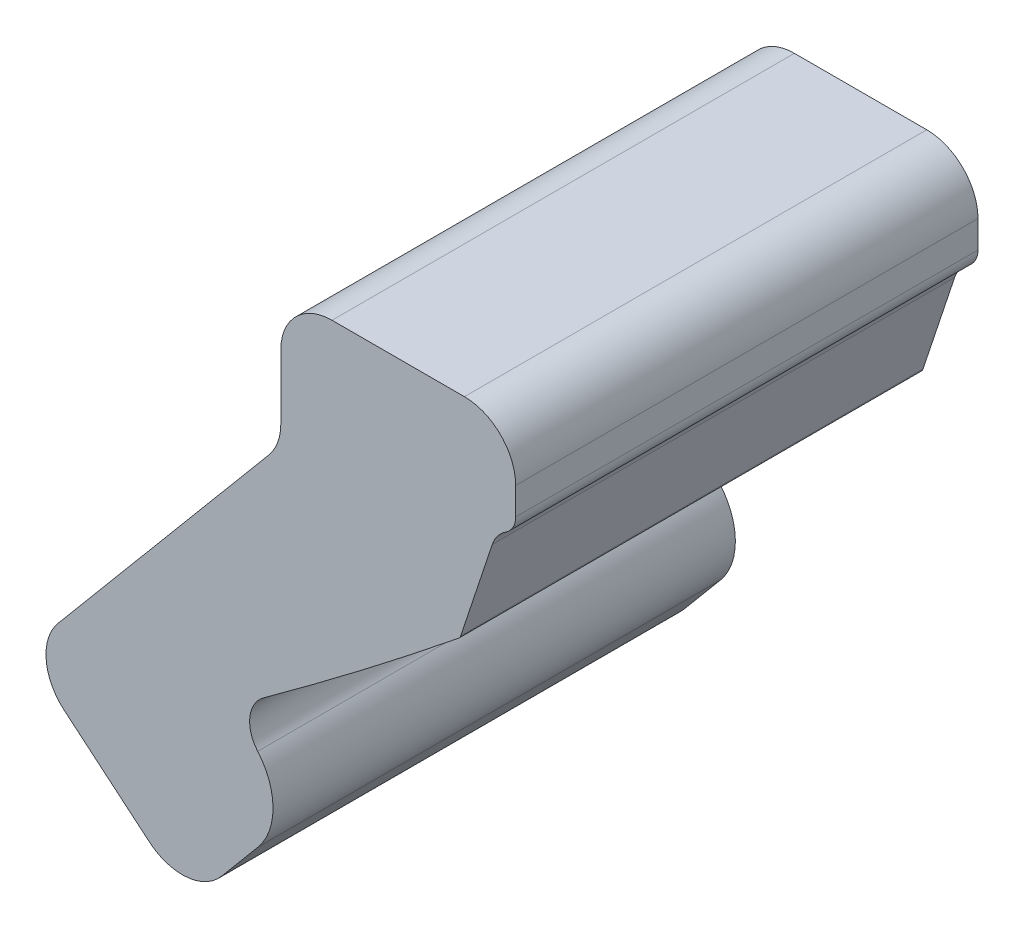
SolidWorks part; units mm, degrees
ref_plane "Front" through (0, 0, 0) normal (0, 0, 1) x (1, 0, 0)
ref_plane "Top" through (0, 0, 0) normal (0, 1, 0) x (1, 0, 0)
ref_plane "Right" through (0, 0, 0) normal (1, 0, 0) x (0, 0, -1)
ref_plane "Plane1" through (0, 0, 71.9582) normal (0, 0, -1) x (-1, 0, 0)
sketch "Sketch1" plane through (0, 0, 71.9582) normal (0, 0, -1) x (-1, 0, 0)
  line L0 (518.4098, -13.1992) -> (532.1912, -13.1992) construction
  line L1 (465.074, -13.1992) -> (532.1912, -13.1992) construction
  line L2 (499.999, -20.8192) -> (499.999, -30.3479)
  line L3 (501.7817, -35.2459) -> (533.1413, -72.6187)
  line L4 (532.202, -83.354) -> (519.5546, -93.9665)
  line L5 (508.8193, -93.0272) -> (466.8567, -43.0181)
  line L6 (465.074, -38.1201) -> (465.074, -20.8192)
  line L8 (472.694, -13.1992) -> (492.379, -13.1992)
  line L9 (459.359, -85.471) -> (459.359, 85.471) construction
  line L28 (467.1367, -5.4507) -> (467.185, -5.5063)
  line L29 (470.3379, -1.325) -> (467.2376, -4.0174)
  line L30 (456.0091, 21.2739) -> (456.1952, 20.2654)
  line L31 (432.0614, 60.5652) -> (432.2004, 59.493)
  line L32 (426.2261, 76.596) -> (425.7905, 73.9476)
  line L33 (431.1692, 80.4921) -> (428.913, 79.7432)
  line L34 (442.3922, 68.2309) -> (441.7414, 68.7387)
  line L35 (466.2786, 28.9295) -> (465.5868, 29.4112)
  line L36 (489.9966, -8.5838) -> (487.8267, -4.6121)
  line L37 (492.579, -13.0808) -> (489.9966, -8.5838)
  line L38 (498.4299, -23.7902) -> (492.579, -13.0808)
  line L39 (490.4548, -35.9487) -> (498.2502, -25.9811)
  line L40 (494.3611, -42.3275) -> (490.5046, -37.8868)
  line L41 (501.2714, -46.7609) -> (495.0911, -42.9478)
  line L42 (515.2956, -65.7245) -> (501.687, -50.0542)
  line L43 (515.0302, -67.9839) -> (515.0872, -67.5125)
  line L44 (521.0991, -73.879) -> (518.6037, -71.0056)
  line L45 (519.194, -76.5426) -> (521.0234, -74.954)
  line L46 (517.0322, -76.6445) -> (519.194, -76.5426)
  line L47 (509.4459, -72.1537) -> (513.3219, -74.806)
  line L48 (467.0862, -26.553) -> (472.9409, -44.1622)
  line L49 (478.6314, -13.0808) -> (479.9517, -15.9471)
  line L50 (477.5788, -10.904) -> (478.6314, -13.0808)
  line L51 (475.055, -5.5405) -> (477.5788, -10.904)
  line L52 (470.5161, -7.7925) -> (473.4927, -5.2075)
  line L53 (469.0345, -7.636) -> (469.0828, -7.6916)
  line L54 (467.1367, -5.4507) -> (467.185, -5.5063) construction
  line L55 (470.3379, -1.325) -> (467.2376, -4.0174) construction
  line L56 (456.0091, 21.2739) -> (456.1952, 20.2654) construction
  line L57 (432.0614, 60.5652) -> (432.2004, 59.493) construction
  line L58 (426.2261, 76.596) -> (425.7905, 73.9476) construction
  line L59 (431.1692, 80.4921) -> (428.913, 79.7432) construction
  line L60 (442.3922, 68.2309) -> (441.7414, 68.7387) construction
  line L61 (466.2786, 28.9295) -> (465.5868, 29.4112) construction
  line L62 (489.9966, -8.5838) -> (487.8267, -4.6121) construction
  line L63 (492.579, -13.0808) -> (489.9966, -8.5838) construction
  line L64 (498.4299, -23.7902) -> (492.579, -13.0808) construction
  line L65 (490.4548, -35.9487) -> (498.2502, -25.9811) construction
  line L66 (494.3611, -42.3275) -> (490.5046, -37.8868) construction
  line L67 (501.2714, -46.7609) -> (495.0911, -42.9478) construction
  line L68 (515.2956, -65.7245) -> (501.687, -50.0542) construction
  line L69 (515.0302, -67.9839) -> (515.0872, -67.5125) construction
  line L70 (521.0991, -73.879) -> (518.6037, -71.0056) construction
  line L71 (519.194, -76.5426) -> (521.0234, -74.954) construction
  line L72 (517.0322, -76.6445) -> (519.194, -76.5426) construction
  line L73 (509.4459, -72.1537) -> (513.3219, -74.806) construction
  line L74 (467.0862, -26.553) -> (472.9409, -44.1622) construction
  line L75 (478.6314, -13.0808) -> (479.9517, -15.9471) construction
  line L76 (477.5788, -10.904) -> (478.6314, -13.0808) construction
  line L78 (470.5161, -7.7925) -> (473.4927, -5.2075) construction
  line L79 (469.0345, -7.636) -> (469.0828, -7.6916) construction
  line L114 (475.055, -5.5405) -> (477.5788, -10.904) construction
  arc A1 (465.074, -20.8192) -> (472.694, -13.1992) centre (472.694, -20.8192) cw
  arc A2 (466.8567, -43.0181) -> (465.074, -38.1201) centre (472.694, -38.1201) cw
  arc A3 (533.1413, -72.6187) -> (532.202, -83.354) centre (527.304, -77.5168) cw
  arc A4 (499.999, -30.3479) -> (501.7817, -35.2459) centre (507.619, -30.3479) ccw
  arc A5 (499.999, -20.8192) -> (492.379, -13.1992) centre (492.379, -20.8192) ccw
  arc A6 (519.5546, -93.9665) -> (508.8193, -93.0272) centre (514.6566, -88.1292) cw
  arc A54 (468.6739, -6.8334) -> (469.0345, -7.636) centre (470.1852, -6.6367) ccw
  arc A55 (468.6739, -6.8334) -> (469.0345, -7.636) centre (470.1852, -6.6367) ccw construction
  arc A56 (467.2376, -4.0174) -> (467.1367, -5.4507) centre (467.9038, -4.7845) ccw
  arc A57 (470.3379, -1.325) -> (470.5052, -0.0019) centre (469.6822, -0.57) ccw
  arc A58 (458.0934, 18.4881) -> (470.5052, -0.0019) centre (1176.9045, 487.596) ccw
  arc A59 (457.85, 19.4364) -> (458.0934, 18.4881) centre (459.3696, 19.321) ccw
  arc A60 (457.85, 19.4364) -> (456.1952, 20.2654) centre (456.8529, 19.5121) ccw
  arc A61 (456.0091, 21.2739) -> (455.5732, 22.3726) centre (453.0117, 20.7206) ccw
  arc A62 (434.0214, 57.6234) -> (455.5732, 22.3726) centre (1176.9045, 487.596) ccw
  arc A63 (433.83, 58.5901) -> (434.0214, 57.6234) centre (435.3404, 58.3868) ccw
  arc A64 (433.83, 58.5901) -> (432.2004, 59.493) centre (432.839, 58.7234) ccw
  arc A65 (432.0614, 60.5652) -> (431.685, 61.6856) centre (429.0387, 60.1732) ccw
  arc A66 (426.2393, 71.3587) -> (431.685, 61.6856) centre (1176.9045, 487.596) ccw
  arc A67 (425.7905, 73.9476) -> (426.2393, 71.3587) centre (429.7375, 73.2984) ccw
  arc A68 (428.913, 79.7432) -> (426.2261, 76.596) centre (430.1731, 75.9469) ccw
  arc A69 (435.9313, 78.6287) -> (431.1692, 80.4921) centre (432.4293, 76.6958) ccw
  arc A70 (435.9313, 78.6287) -> (440.9661, 69.6365) centre (1176.9045, 487.596) ccw
  arc A71 (440.9661, 69.6365) -> (441.7414, 68.7387) centre (443.6165, 71.1417) ccw
  arc A72 (442.3922, 68.2309) -> (442.3899, 66.32) centre (442.6863, 67.2751) ccw
  arc A73 (443.2592, 65.6244) -> (442.3899, 66.32) centre (441.9381, 64.8645) ccw
  arc A74 (443.2592, 65.6244) -> (464.7639, 30.2655) centre (1176.9045, 487.596) ccw
  arc A75 (464.7639, 30.2655) -> (465.5868, 29.4112) centre (467.3285, 31.9125) ccw
  arc A76 (466.2786, 28.9295) -> (466.3709, 27.0156) centre (466.611, 27.9863) ccw
  arc A77 (467.2827, 26.3667) -> (466.3709, 27.0156) centre (466.0049, 25.5362) ccw
  arc A78 (467.2827, 26.3667) -> (478.1858, 10.0107) centre (1176.9045, 487.596) ccw
  arc A79 (481.4091, 4.5472) -> (478.1858, 10.0107) centre (433.8251, -19.8428) ccw
  arc A80 (468.6739, -6.8334) -> (467.185, -5.5063) centre (467.1627, -7.0301) ccw
  arc A81 (468.6739, -6.8334) -> (467.185, -5.5063) centre (467.1627, -7.0301) ccw construction
  arc A82 (482.8335, 1.5414) -> (482.6281, 2.0061) centre (433.8251, -19.8428) ccw
  arc A83 (482.8335, 1.5414) -> (483.4172, 1.1898) centre (483.373, 1.7768) ccw
  arc A84 (484.3046, 0.9984) -> (483.4172, 1.1898) centre (483.5374, -0.4056) ccw
  arc A85 (484.6707, 0.6547) -> (484.3046, 0.9984) centre (483.8251, 0.1209) ccw
  arc A86 (486.9383, -3.0725) -> (484.6707, 0.6547) centre (372.8092, -69.9538) ccw
  arc A87 (487.3917, -3.8375) -> (486.9383, -3.0725) centre (454.3881, -22.8808) ccw
  arc A88 (487.8267, -4.6121) -> (487.3917, -3.8375) centre (405.3022, -50.4461) ccw
  arc A89 (498.2502, -25.9811) -> (498.4299, -23.7902) centre (496.6747, -24.7491) ccw
  arc A90 (490.4548, -35.9487) -> (490.5046, -37.8868) centre (491.6553, -36.8875) ccw
  arc A91 (494.3611, -42.3275) -> (495.0911, -42.9478) centre (496.7583, -40.2457) ccw
  arc A92 (501.5778, -48.1973) -> (501.2714, -46.7609) centre (500.738, -47.6256) ccw
  arc A93 (501.5778, -48.1973) -> (501.687, -50.0542) centre (502.8376, -49.0549) ccw
  arc A94 (515.3857, -66.5953) -> (515.2956, -65.7245) centre (514.7202, -66.2241) ccw
  arc A95 (515.3857, -66.5953) -> (515.0872, -67.5125) centre (517.5691, -67.813) ccw
  arc A96 (515.0302, -67.9839) -> (517.9078, -70.7528) centre (517.5121, -68.2843) ccw
  arc A97 (518.6037, -71.0056) -> (517.9078, -70.7528) centre (518.0284, -71.5052) ccw
  arc A98 (521.0234, -74.954) -> (521.0991, -73.879) centre (520.5237, -74.3786) ccw
  arc A99 (515.1192, -76.0817) -> (517.0322, -76.6445) centre (516.8887, -73.5999) ccw
  arc A100 (515.1192, -76.0817) -> (513.3219, -74.806) centre (214.4421, -497.8086) ccw
  arc A101 (473.5833, -45.0881) -> (509.4459, -72.1537) centre (912.9773, 499.8274) ccw
  arc A102 (472.9409, -44.1622) -> (473.5833, -45.0881) centre (474.8387, -43.5312) ccw
  arc A103 (472.8569, -21.1528) -> (467.0862, -26.553) centre (471.214, -25.1806) ccw
  arc A104 (472.8569, -21.1528) -> (479.8788, -18.602) centre (474.9589, -15.999) ccw
  arc A105 (479.8788, -18.602) -> (479.9517, -15.9471) centre (477.2303, -17.2007) ccw
  arc A106 (475.055, -5.5405) -> (473.4927, -5.2075) centre (474.1484, -5.9625) ccw
  arc A107 (469.0828, -7.6916) -> (470.5161, -7.7925) centre (469.8499, -7.0254) ccw
  arc A110 (467.2376, -4.0174) -> (467.1367, -5.4507) centre (467.9038, -4.7845) ccw construction
  arc A111 (470.3379, -1.325) -> (470.5052, -0.0019) centre (469.6822, -0.57) ccw construction
  arc A112 (458.0934, 18.4881) -> (470.5052, -0.0019) centre (1176.9045, 487.596) ccw construction
  arc A113 (457.85, 19.4364) -> (458.0934, 18.4881) centre (459.3696, 19.321) ccw construction
  arc A114 (457.85, 19.4364) -> (456.1952, 20.2654) centre (456.8529, 19.5121) ccw construction
  arc A115 (456.0091, 21.2739) -> (455.5732, 22.3726) centre (453.0117, 20.7206) ccw construction
  arc A116 (434.0214, 57.6234) -> (455.5732, 22.3726) centre (1176.9045, 487.596) ccw construction
  arc A117 (433.83, 58.5901) -> (434.0214, 57.6234) centre (435.3404, 58.3868) ccw construction
  arc A118 (433.83, 58.5901) -> (432.2004, 59.493) centre (432.839, 58.7234) ccw construction
  arc A119 (432.0614, 60.5652) -> (431.685, 61.6856) centre (429.0387, 60.1732) ccw construction
  arc A120 (426.2393, 71.3587) -> (431.685, 61.6856) centre (1176.9045, 487.596) ccw construction
  arc A121 (425.7905, 73.9476) -> (426.2393, 71.3587) centre (429.7375, 73.2984) ccw construction
  arc A122 (428.913, 79.7432) -> (426.2261, 76.596) centre (430.1731, 75.9469) ccw construction
  arc A123 (435.9313, 78.6287) -> (431.1692, 80.4921) centre (432.4293, 76.6958) ccw construction
  arc A124 (435.9313, 78.6287) -> (440.9661, 69.6365) centre (1176.9045, 487.596) ccw construction
  arc A125 (440.9661, 69.6365) -> (441.7414, 68.7387) centre (443.6165, 71.1417) ccw construction
  arc A126 (442.3922, 68.2309) -> (442.3899, 66.32) centre (442.6863, 67.2751) ccw construction
  arc A127 (443.2592, 65.6244) -> (442.3899, 66.32) centre (441.9381, 64.8645) ccw construction
  arc A128 (443.2592, 65.6244) -> (464.7639, 30.2655) centre (1176.9045, 487.596) ccw construction
  arc A129 (464.7639, 30.2655) -> (465.5868, 29.4112) centre (467.3285, 31.9125) ccw construction
  arc A130 (466.2786, 28.9295) -> (466.3709, 27.0156) centre (466.611, 27.9863) ccw construction
  arc A131 (467.2827, 26.3667) -> (466.3709, 27.0156) centre (466.0049, 25.5362) ccw construction
  arc A132 (467.2827, 26.3667) -> (478.1858, 10.0107) centre (1176.9045, 487.596) ccw construction
  arc A133 (481.4091, 4.5472) -> (478.1858, 10.0107) centre (433.8251, -19.8428) ccw construction
  arc A136 (482.8335, 1.5414) -> (482.6281, 2.0061) centre (433.8251, -19.8428) ccw construction
  arc A137 (482.8335, 1.5414) -> (483.4172, 1.1898) centre (483.373, 1.7768) ccw construction
  arc A138 (484.3046, 0.9984) -> (483.4172, 1.1898) centre (483.5374, -0.4056) ccw construction
  arc A139 (484.6707, 0.6547) -> (484.3046, 0.9984) centre (483.8251, 0.1209) ccw construction
  arc A140 (486.9383, -3.0725) -> (484.6707, 0.6547) centre (372.8092, -69.9538) ccw construction
  arc A141 (487.3917, -3.8375) -> (486.9383, -3.0725) centre (454.3881, -22.8808) ccw construction
  arc A142 (487.8267, -4.6121) -> (487.3917, -3.8375) centre (405.3022, -50.4461) ccw construction
  arc A143 (498.2502, -25.9811) -> (498.4299, -23.7902) centre (496.6747, -24.7491) ccw construction
  arc A144 (490.4548, -35.9487) -> (490.5046, -37.8868) centre (491.6553, -36.8875) ccw construction
  arc A145 (494.3611, -42.3275) -> (495.0911, -42.9478) centre (496.7583, -40.2457) ccw construction
  arc A146 (501.5778, -48.1973) -> (501.2714, -46.7609) centre (500.738, -47.6256) ccw construction
  arc A147 (501.5778, -48.1973) -> (501.687, -50.0542) centre (502.8376, -49.0549) ccw construction
  arc A148 (515.3857, -66.5953) -> (515.2956, -65.7245) centre (514.7202, -66.2241) ccw construction
  arc A149 (515.3857, -66.5953) -> (515.0872, -67.5125) centre (517.5691, -67.813) ccw construction
  arc A150 (515.0302, -67.9839) -> (517.9078, -70.7528) centre (517.5121, -68.2843) ccw construction
  arc A151 (518.6037, -71.0056) -> (517.9078, -70.7528) centre (518.0284, -71.5052) ccw construction
  arc A152 (521.0234, -74.954) -> (521.0991, -73.879) centre (520.5237, -74.3786) ccw construction
  arc A154 (515.1192, -76.0817) -> (513.3219, -74.806) centre (214.4421, -497.8086) ccw construction
  arc A155 (473.5833, -45.0881) -> (509.4459, -72.1537) centre (912.9773, 499.8274) ccw construction
  arc A156 (472.9409, -44.1622) -> (473.5833, -45.0881) centre (474.8387, -43.5312) ccw construction
  arc A157 (472.8569, -21.1528) -> (467.0862, -26.553) centre (471.214, -25.1806) ccw construction
  arc A158 (472.8569, -21.1528) -> (479.8788, -18.602) centre (474.9589, -15.999) ccw construction
  arc A159 (479.8788, -18.602) -> (479.9517, -15.9471) centre (477.2303, -17.2007) ccw construction
  arc A160 (475.055, -5.5405) -> (473.4927, -5.2075) centre (474.1484, -5.9625) ccw construction
  arc A161 (469.0828, -7.6916) -> (470.5161, -7.7925) centre (469.8499, -7.0254) ccw construction
  arc A222 (481.4091, 4.5472) -> (482.0313, 2.6841) centre (482.8255, 3.9848) ccw
  arc A223 (481.4091, 4.5472) -> (482.0313, 2.6841) centre (482.8255, 3.9848) ccw construction
  arc A224 (482.6281, 2.0061) -> (482.0313, 2.6841) centre (481.2371, 1.3833) ccw
  arc A225 (482.6281, 2.0061) -> (482.0313, 2.6841) centre (481.2371, 1.3833) ccw construction
  arc A226 (515.1192, -76.0817) -> (517.0322, -76.6445) centre (516.8887, -73.5999) ccw construction
  point P70 (499.999, -13.1992)
  dimension "D4" = 7.62
  dimension "D2" = 31.75
  dimension "D3" = 34.925
  dimension "D5" = 82.55
  dimension "D6" = 50
  dimension "D7" = 69.85
  dimension "D8" = 5.715
  dimension "D1" = 0
extrude "Boss-Extrude1" add sketch "Sketch1" along normal blind 96.393
surface "Surface-Offset1" parameters "D1"=0
ref_plane "Plane3" through (0, 0, 3.2) normal (0, 0, 1) x (1, 0, 0)
other "SurfaceCut1"
delete or keep bodies "Body-Delete/Keep 1" type delete bodies bodies 104
sketch "Sketch2" plane through (0, 0, 71.9582) normal (0, 0, 1) x (1, 0, 0)
  line L0 (-532.202, -83.354) -> (-519.5546, -93.9665) construction
  line L2 (-466.8567, -43.0181) -> (-508.8193, -93.0272) construction
  line L3 (-489.0021, -69.41) -> (-497.3906, -79.407)
  line L8 (-497.3906, -79.407) -> (-502.8468, -74.8287)
  line L12 (-468.5555, -30.1673) -> (-473.2495, -44.2854)
  line L13 (-463.729, -47.4508) -> (-459.035, -33.3327)
  line L14 (-468.5555, -30.1673) -> (-473.2495, -44.2854)
  line L15 (-463.729, -47.4508) -> (-459.035, -33.3327)
  arc A15 (-498.5398, -63.9864) -> (-492.5976, -72.0704) centre (-495.5687, -68.0284) ccw
  arc A16 (-498.5398, -63.9864) -> (-473.5756, -44.7555) centre (-912.9773, 499.8274) ccw
  arc A17 (-473.5756, -44.7555) -> (-473.2495, -44.2854) centre (-474.2136, -43.9648) ccw
  arc A22 (-502.5645, -66.9228) -> (-502.8468, -74.8287) centre (-499.6222, -70.9858) ccw
  arc A24 (-459.035, -33.3327) -> (-468.5555, -30.1673) centre (-463.7952, -31.75) ccw
  arc A25 (-467.2755, -52.5638) -> (-463.729, -47.4508) centre (-474.2136, -43.9648) ccw
  arc A26 (-492.5976, -72.0704) -> (-467.2755, -52.5638) centre (-912.9773, 499.8274) ccw
  arc A28 (-502.5645, -66.9228) -> (-473.5756, -44.7555) centre (-912.9773, 499.8274) ccw
  arc A29 (-473.5756, -44.7555) -> (-473.2495, -44.2854) centre (-474.2136, -43.9648) ccw
  arc A30 (-459.035, -33.3327) -> (-468.5555, -30.1673) centre (-463.7952, -31.75) ccw
  arc A31 (-467.2755, -52.5638) -> (-463.729, -47.4508) centre (-474.2136, -43.9648) ccw
  arc A32 (-489.0021, -69.41) -> (-467.2755, -52.5638) centre (-912.9773, 499.8274) ccw
  dimension "D2" = 5.0165
  dimension "D3" = 25.4
  dimension "D1" = 0.254
extrude "Cut-Extrude1" cut sketch "Sketch2" against normal through all
fillet "Fillet1" radius 3.175 1 edges at (-465.074, -26.8992, 37.5791)
fillet "Fillet2" radius 9.525 1 edges at (-497.3906, -79.407, 37.5791)
sketch "Sketch3" plane through (0, 0, 3.2) normal (0, 0, -1) x (-1, 0, 0)
  line L0 (528.6555, -85.96) -> (519.6564, -93.5111)
  line L1 (529.5948, -75.2247) -> (485.4095, -22.5668)
  line L2 (508.9211, -92.5719) -> (464.7359, -39.914)
  line L3 (476.4634, -21.7841) -> (465.5186, -30.9679)
  line L4 (500.159, -20.8192) -> (500.159, -30.3479) construction
  line L5 (452.12, -180.975) -> (452.12, 149.225) construction
  arc A0 (485.4095, -22.5668) -> (476.4634, -21.7841) centre (480.5451, -26.6485) ccw
  arc A1 (464.7359, -39.914) -> (465.5186, -30.9679) centre (469.6003, -35.8323) cw
  arc A2 (519.6564, -93.5111) -> (508.9211, -92.5719) centre (514.7584, -87.6739) cw
  arc A3 (529.5948, -75.2247) -> (528.6555, -85.96) centre (523.7575, -80.1227) cw
  point P14 (471.4147, -16.5401)
  dimension "D4" = 6.35
  dimension "D5" = 7.62
  dimension "D6" = 7.62
  dimension "D1" = 26.9875
  dimension "D2" = 82.71
  dimension "D3" = 40
  dimension "D7" = 11.1303
